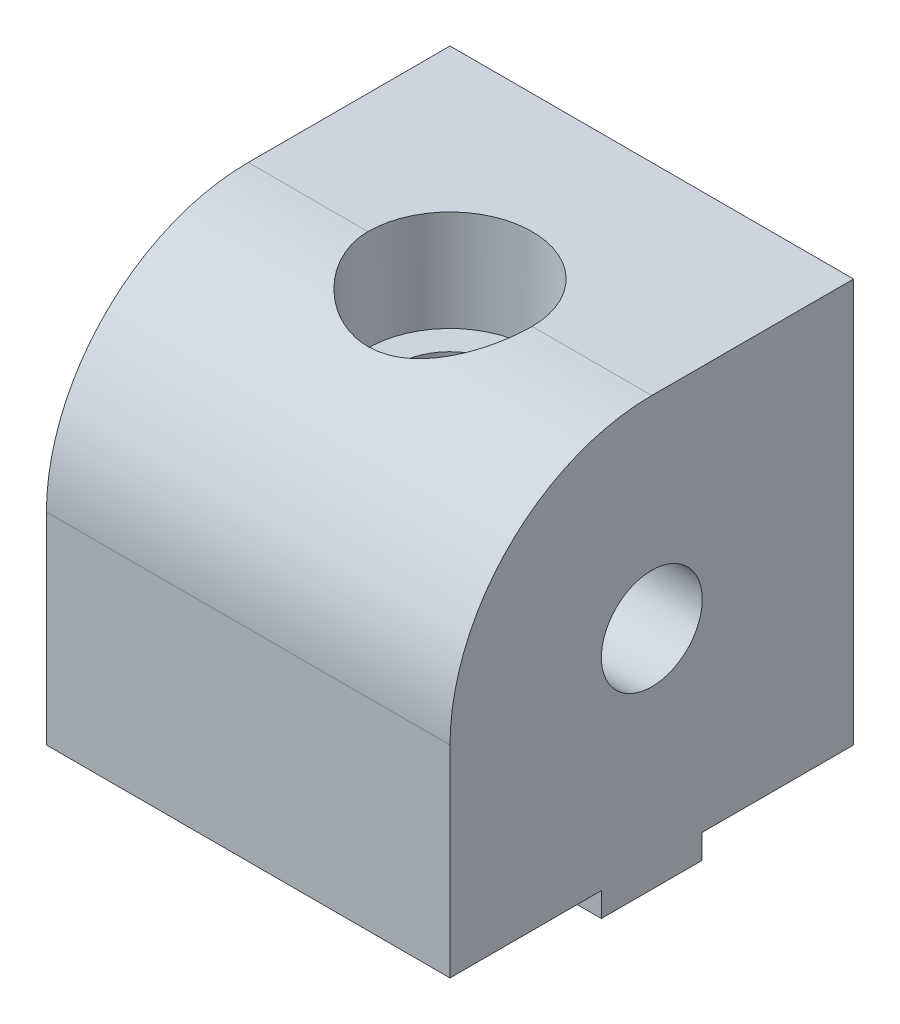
SolidWorks part; units mm, degrees
ref_plane "Front Plane" through (0, 0, 0) normal (0, 0, 1) x (1, 0, 0)
ref_plane "Top Plane" through (0, 0, 0) normal (0, 1, 0) x (1, 0, 0)
ref_plane "Right Plane" through (0, 0, 0) normal (1, 0, 0) x (0, 0, -1)
sketch "Sketch1" plane through (0, 0, 0) normal (0, 1, 0) x (1, 0, 0)
  line L1 (-12.7, -12.7) -> (12.7, -12.7)
  line L2 (-12.7, -12.7) -> (-12.7, 12.7)
  line L3 (-12.7, 12.7) -> (12.7, 12.7)
  line L4 (12.7, -12.7) -> (12.7, 12.7)
  line L5 (-12.7, -12.7) -> (12.7, 12.7) construction
  line L6 (-12.7, 12.7) -> (12.7, -12.7) construction
  point P0 (0, 0)
  dimension "D1" = 25.4
  dimension "D2" = 25.4
extrude "Boss-Extrude1" add sketch "Sketch1" along normal blind 25.4
fillet "Fillet1" radius 12.7 1 edges at (0, 25.4, 12.7)
ref_plane "Plane1" through (0, 25.4, 0) normal (0, 1, 0) x (1, 0, 0)
sketch "Sketch2" plane through (0, 25.4, 0) normal (0, 1, 0) x (1, 0, 0)
  circle A0 centre (0, 0) radius 3.3782
  dimension "D1" = 6.7564
extrude "Cut-Extrude1" cut sketch "Sketch2" against normal through all
sketch "Sketch3" plane through (12.7, 0, 0) normal (1, 0, 0) x (0, 0, -1)
  line L0 (0, 12.7) -> (-12.7, 12.7) construction
  line L1 (0, 12.7) -> (0, 0) construction
  circle A0 centre (0, 12.7) radius 3.175
  dimension "D1" = 6.35
extrude "Cut-Extrude2" cut sketch "Sketch3" against normal through all
sketch "Sketch4" plane through (0, 25.4, 0) normal (0, 1, 0) x (1, 0, 0)
  circle A0 centre (0, 0) radius 5.1689
  dimension "D1" = 10.3378
extrude "Cut-Extrude3" cut sketch "Sketch4" against normal blind 6.35
sketch "Sketch5" plane through (0, 0, 0) normal (0, -1, 0) x (1, 0, 0)
  line L0 (-12.7, -12.7) -> (-12.7, 12.7) construction
  line L1 (-12.7, 3.175) -> (-6.35, 3.175)
  line L2 (-12.7, 3.175) -> (-12.7, -3.175)
  line L3 (-12.7, -3.175) -> (-6.35, -3.175)
  line L4 (-6.35, 3.175) -> (-6.35, -3.175)
  line L5 (-6.35, 0) -> (0, 0) construction
  line L6 (0, 12.7) -> (0, -12.7) construction
  line L7 (-12.7, 12.7) -> (12.7, 12.7) construction
  line L8 (12.7, -12.7) -> (-12.7, -12.7) construction
  line L9 (6.35, 3.175) -> (6.35, -3.175)
  line L10 (12.7, -3.175) -> (6.35, -3.175)
  line L11 (12.7, 3.175) -> (12.7, -3.175)
  line L12 (12.7, 3.175) -> (6.35, 3.175)
  dimension "D1" = 6.35
  dimension "D2" = 6.35
extrude "Boss-Extrude2" add sketch "Sketch5" along normal blind 1.524
